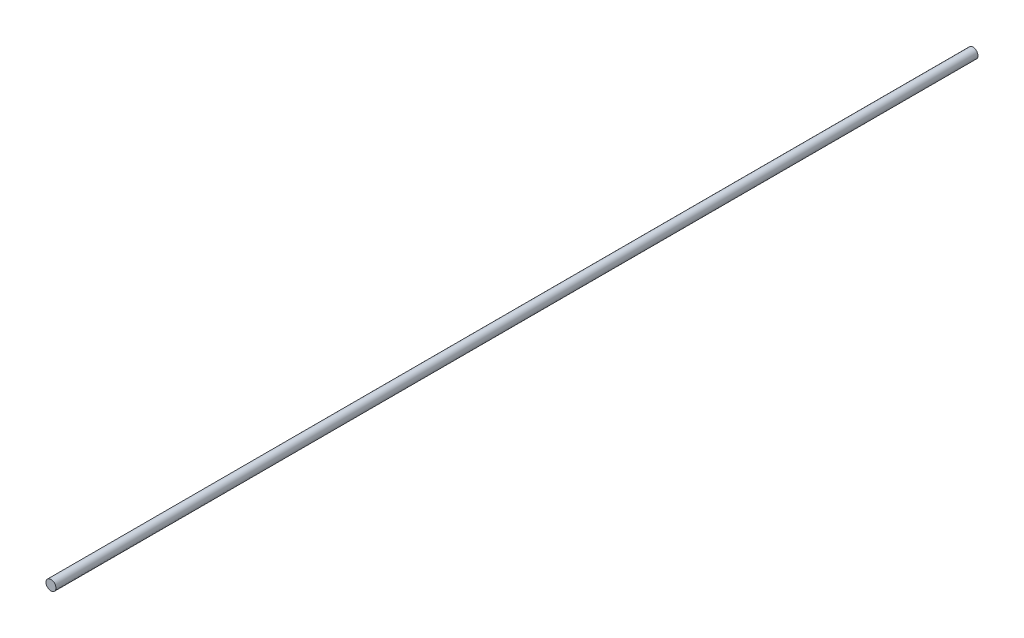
SolidWorks part; units mm, degrees
ref_plane "Front Plane" through (0, 0, 0) normal (0, 0, 1) x (1, 0, 0)
ref_plane "Top Plane" through (0, 0, 0) normal (0, 1, 0) x (1, 0, 0)
ref_plane "Right Plane" through (0, 0, 0) normal (1, 0, 0) x (0, 0, -1)
sketch "Sketch1" plane through (0, 0, 0) normal (0, 0, 1) x (1, 0, 0)
  circle A0 centre (0, 0) radius 30
  dimension "D1" = 60
extrude "Boss-Extrude1" add sketch "Sketch1" against normal blind 5550
